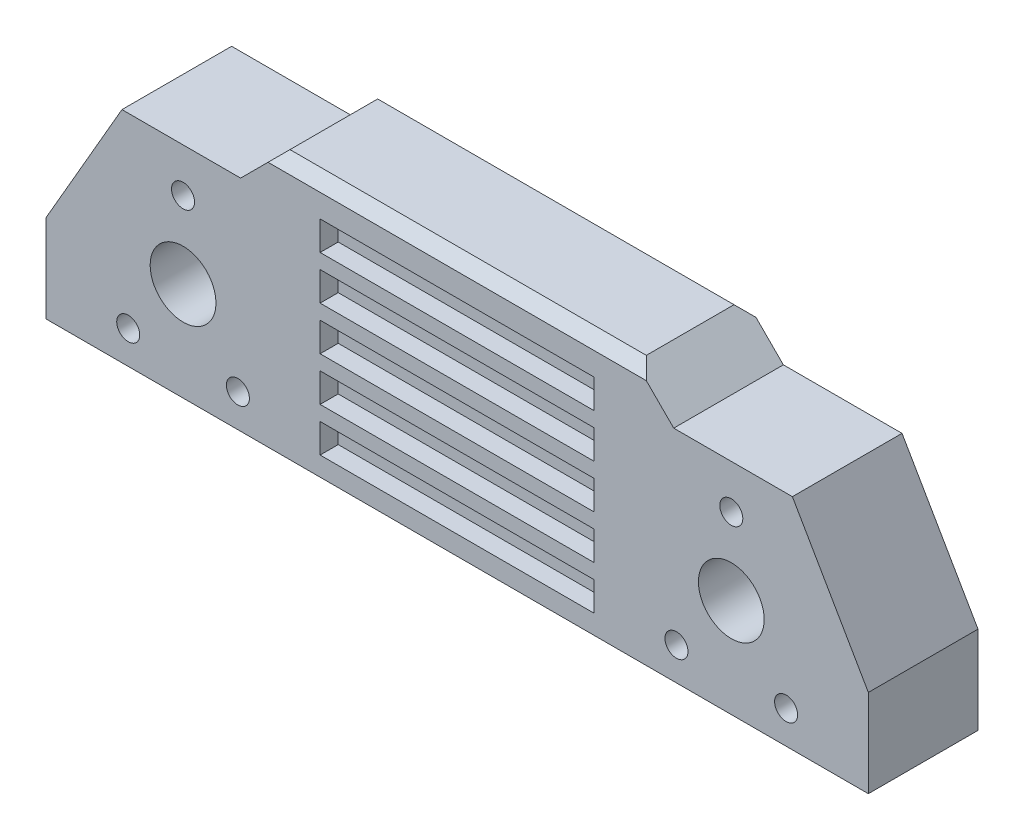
SolidWorks part; units mm, degrees
ref_plane "Front" through (0, 0, 0) normal (0, 0, 1) x (1, 0, 0)
ref_plane "Top" through (0, 0, 0) normal (0, 1, 0) x (1, 0, 0)
ref_plane "Right" through (0, 0, 0) normal (1, 0, 0) x (0, 0, -1)
sketch "Sketch4" plane through (0, 0, 0) normal (0, 0, 1) x (1, 0, 0)
  line L0 (0, 0) -> (0, 47) construction
  line L1 (-75, 0) -> (75, 0)
  line L2 (75, 0) -> (75, 16)
  line L3 (75, 16) -> (61.1436, 40)
  line L4 (61.1436, 40) -> (39.5, 40)
  line L5 (39.5, 40) -> (32.5, 47)
  line L6 (32.5, 47) -> (-32.5, 47)
  line L7 (-39.5, 40) -> (-32.5, 47)
  line L8 (-61.1436, 40) -> (-39.5, 40)
  line L9 (-75, 16) -> (-61.1436, 40)
  line L10 (-75, 0) -> (-75, 16)
  circle A0 centre (50, 18) radius 6
  circle A1 centre (-50, 18) radius 6
  point P11 (0, 47)
  dimension "D8" = 12
  dimension "D1" = 150
  dimension "D2" = 47
  dimension "D3" = 16
  dimension "D4" = 65
  dimension "D5" = 40
  dimension "D6" = 30
  dimension "D7" = 45
  dimension "D9" = 18
  dimension "D10" = 100
extrude "Boss-Extrude2" add sketch "Sketch4" along normal mid plane 20
hole_wizard "M5 Tapped Hole2" positions "Sketch8" profile "Sketch9" tap size "M5" standard "ISO"
sketch "Sketch8" plane through (0, 0, 10) normal (0, 0, 1) x (1, 0, 0)
  line L8 (50, 32) -> (50, 18) construction
  line L9 (50, 18) -> (60, 6) construction
  line L12 (50, 18) -> (40, 6) construction
  line L15 (75, 0) -> (75, 16) construction
  point P162 (50, 32)
  point P164 (40, 6)
  point P166 (60, 6)
  point P184 (0, 0)
  dimension "D1" = 14
  dimension "D2" = 12
  dimension "D3" = 15
sketch "Sketch9" plane through (50, 32, 10) normal (1, 0, 0) x (0, -1, 0)
  line L0 (0, 0) -> (0, 15.2618)
  line L1 (0, 15.2618) -> (2.1, 14)
  line L2 (2.1, 14) -> (2.1, 0)
  line L5 (2.1, 0) -> (0, 0)
  line L10 (0, 15.2618) -> (-2.1, 14) construction
  line L11 (0, -6.35) -> (0, 107.95) construction
  dimension "Tap Drill Dia." = 4.2
  dimension "Tap Drill Depth" = 14
  dimension "Drill Angle" = 118
sketch "Sketch10" plane through (0, 0, 0) normal (1, 0, 0) x (0, 0, -1)
  line L0 (-6.7, 3.5) -> (-6.7, 6.2)
  line L1 (-6.7, 6.2) -> (-10, 8.8)
  line L2 (-10, 8.8) -> (-10, 3.5)
  line L3 (-10, 3.5) -> (-6.7, 3.5)
  line L4 (-10, 0) -> (-10, 16) construction
  line L5 (-10, 0) -> (10, 0) construction
  dimension "D1" = 3.3
  dimension "D2" = 2.7
  dimension "D3" = 5.3
  dimension "D4" = 3.5
extrude "Cut-Extrude2" cut sketch "Sketch10" against normal mid plane 50
pattern_linear "LPattern1" count 5 spacing 8 along (0, 1, 0) of "Cut-Extrude2"
chamfer "Chamfer1" distance 2 angle 45 2 edges at (0, 47, -10) (0, 47, 10)
mirror "Mirror2" about plane through (0, 0, 0) normal (1, 0, 0) of "M5 Tapped Hole2"
